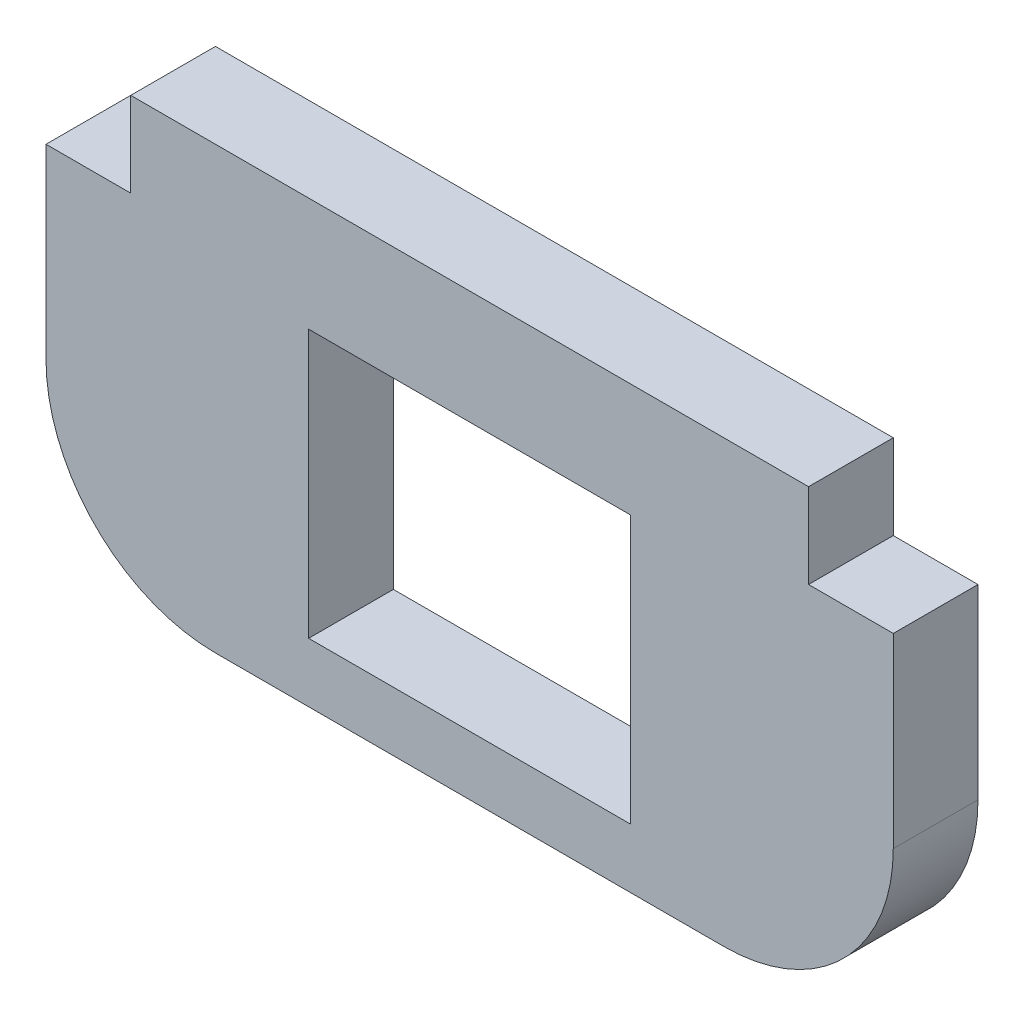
SolidWorks part; units mm, degrees
ref_plane "Front Plane" through (0, 0, 0) normal (0, 0, 1) x (1, 0, 0)
ref_plane "Top Plane" through (0, 0, 0) normal (0, 1, 0) x (1, 0, 0)
ref_plane "Right Plane" through (0, 0, 0) normal (1, 0, 0) x (0, 0, -1)
sketch "Sketch1" plane through (0, 0, 0) normal (0, 0, 1) x (1, 0, 0)
  line L1 (-15.875, 8.255) -> (15.875, 8.255)
  line L2 (-15.875, 8.255) -> (-15.875, -8.255)
  line L3 (-15.875, -8.255) -> (15.875, -8.255)
  line L4 (15.875, 8.255) -> (15.875, -8.255)
  line L5 (-15.875, 8.255) -> (15.875, -8.255) construction
  line L6 (-15.875, -8.255) -> (15.875, 8.255) construction
  point P0 (0, 0)
  dimension "D1" = 31.75
  dimension "D2" = 16.51
extrude "Boss-Extrude1" add sketch "Sketch1" along normal mid plane 3.175
sketch "Sketch2" plane through (0, 0, 1.5875) normal (0, 0, 1) x (1, 0, 0)
  line L0 (0, 13.5162) -> (0, -14.4625) construction
  line L1 (-15.875, 8.255) -> (-12.7, 8.255)
  line L2 (-15.875, 8.255) -> (-15.875, 5.08)
  line L3 (-15.875, 5.08) -> (-12.7, 5.08)
  line L4 (-12.7, 8.255) -> (-12.7, 5.08)
  line L5 (12.7, 8.255) -> (12.7, 5.08)
  line L6 (15.875, 5.08) -> (12.7, 5.08)
  line L7 (15.875, 8.255) -> (15.875, 5.08)
  line L8 (15.875, 8.255) -> (12.7, 8.255)
  dimension "D1" = 3.175
  dimension "D2" = 3.175
extrude "Cut-Extrude1" cut sketch "Sketch2" against normal through all
sketch "Sketch3" plane through (0, 0, 1.5875) normal (0, 0, 1) x (1, 0, 0)
  line L0 (-12.7, 5.08) -> (12.7, 5.08) construction
  line L1 (0, 5.08) -> (0, -1.016) construction
  line L3 (-6.0325, 4.0005) -> (6.0325, 4.0005)
  line L4 (-6.0325, 4.0005) -> (-6.0325, -6.0325)
  line L5 (-6.0325, -6.0325) -> (6.0325, -6.0325)
  line L6 (6.0325, 4.0005) -> (6.0325, -6.0325)
  line L7 (-6.0325, 4.0005) -> (6.0325, -6.0325) construction
  line L8 (-6.0325, -6.0325) -> (6.0325, 4.0005) construction
  dimension "D1" = 6.096
  dimension "D2" = 10.033
  dimension "D3" = 12.065
extrude "Cut-Extrude2" cut sketch "Sketch3" against normal through all
fillet "Fillet1" radius 6.35 2 edges at (15.875, -8.255, 0) (-15.875, -8.255, 0)
